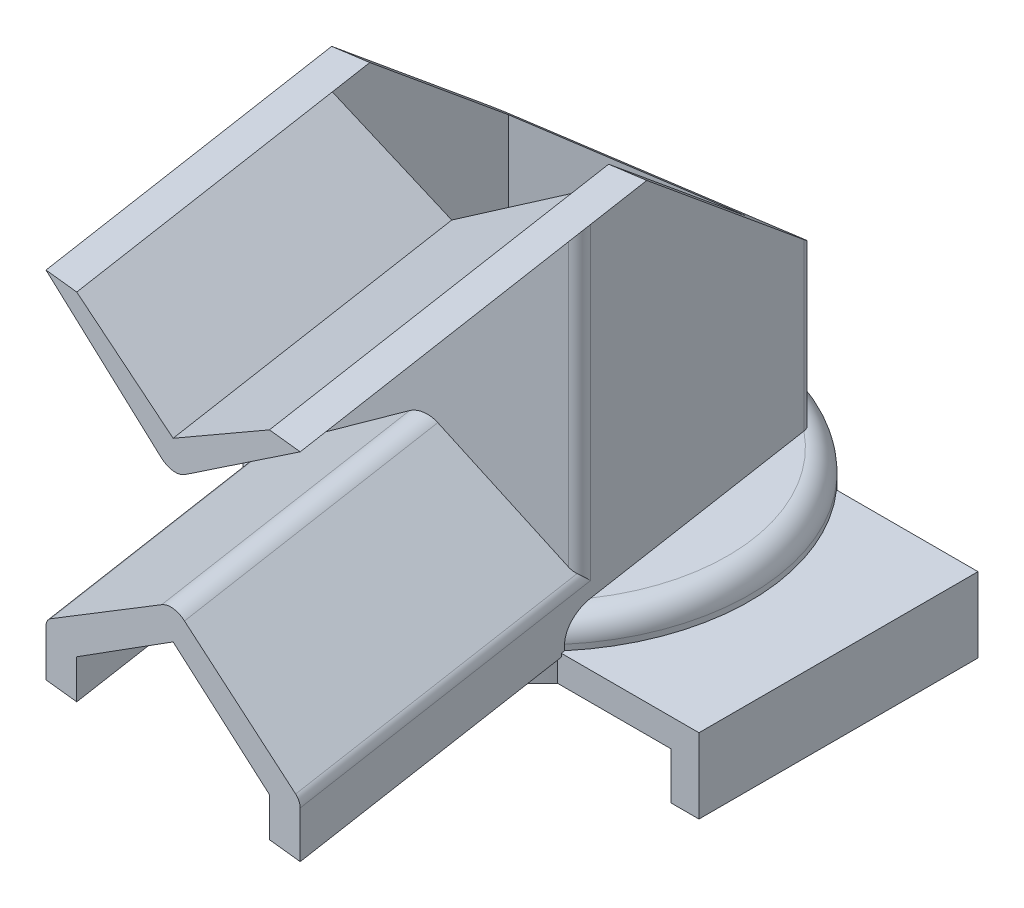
SolidWorks part; units mm, degrees
ref_plane "Front Plane" through (0, 0, 0) normal (0, 0, 1) x (1, 0, 0)
ref_plane "Top Plane" through (0, 0, 0) normal (0, 1, 0) x (1, 0, 0)
ref_plane "Right Plane" through (0, 0, 0) normal (1, 0, 0) x (0, 0, -1)
sketch "Sketch1" plane through (0, 0, 0) normal (0, 1, 0) x (1, 0, 0)
  circle A0 centre (0, 0) radius 6.1
  circle A1 centre (0, 0) radius 3.4
extrude "Boss-Extrude1" add sketch "Sketch1" along normal blind 3.7
sketch "Sketch2" plane through (0, 3.7, 0) normal (0, 1, 0) x (1, 0, 0)
  circle A0 centre (0, 0) radius 18.83
extrude "Boss-Extrude2" add sketch "Sketch2" along normal blind 5
sketch "Sketch5" plane through (0, 3.7, 0) normal (0, -1, 0) x (-1, 0, 0)
  line L0 (0, 0) -> (-21.3385, 0) construction
  line L2 (-10.7614, 12.5) -> (-26.7614, 12.5)
  line L3 (-10.7614, 12.5) -> (-10.7614, -12.5)
  line L4 (-10.7614, -12.5) -> (-26.7614, -12.5)
  line L5 (-26.7614, 12.5) -> (-26.7614, -12.5)
  line L6 (-10.7614, 12.5) -> (-26.7614, -12.5) construction
  line L7 (-10.7614, -12.5) -> (-26.7614, 12.5) construction
  point P3 (-18.7614, 0)
  dimension "D1" = 25
  dimension "D2" = 8
extrude "Boss-Extrude3" add sketch "Sketch5" against normal blind 2.5
sketch "Sketch6" plane through (0, 3.7, 0) normal (0, -1, 0) x (1, 0, 0)
  line L0 (14.0826, -12.5) -> (26.7614, -12.5) construction
  line L1 (26.7614, 12.5) -> (24.2614, 12.5)
  line L2 (26.7614, 12.5) -> (26.7614, -12.5)
  line L3 (26.7614, -12.5) -> (24.2614, -12.5)
  line L4 (24.2614, 12.5) -> (24.2614, -12.5)
  dimension "D1" = 2.5
extrude "Boss-Extrude4" add sketch "Sketch6" along normal blind 4.2
sketch "Sketch7" plane through (0, 8.7, 0) normal (0, 1, 0) x (1, 0, 0)
  line L0 (0, 0) -> (0, 21.2642) construction
  line L1 (14.1148, -10.4063) -> (-10.4063, -14.1148)
  line L2 (14.1148, -10.4063) -> (10.4063, 14.1148)
  line L3 (10.4063, 14.1148) -> (-14.1148, 10.4063)
  line L4 (-10.4063, -14.1148) -> (-14.1148, 10.4063)
  line L5 (14.1148, -10.4063) -> (-14.1148, 10.4063) construction
  line L6 (10.4063, 14.1148) -> (-10.4063, -14.1148) construction
  point P0 (0, 0)
  dimension "D1" = 24.8
  dimension "D2" = 24.8
  dimension "D3" = 8.6
  dimension "D5" = 12.4
  dimension "D6" = 12.4
extrude "Boss-Extrude5" add sketch "Sketch7" along normal blind 29
sketch "Sketch8" plane through (0, 37.7, 0) normal (0, 1, 0) x (1, 0, 0)
  line L0 (-10.4063, -14.1148) -> (14.1148, -10.4063) construction
  line L1 (10.6999, -7.8887) -> (-7.8887, -10.6999)
  line L2 (10.6999, -7.8887) -> (7.8887, 10.6999)
  line L3 (7.8887, 10.6999) -> (-10.6999, 7.8887)
  line L4 (-7.8887, -10.6999) -> (-10.6999, 7.8887)
  line L5 (10.6999, -7.8887) -> (-10.6999, 7.8887) construction
  line L6 (7.8887, 10.6999) -> (-7.8887, -10.6999) construction
  line L7 (10.4063, 14.1148) -> (-14.1148, 10.4063) construction
  line L8 (14.1148, -10.4063) -> (10.4063, 14.1148) construction
  line L9 (-14.1148, 10.4063) -> (-10.4063, -14.1148) construction
  point P0 (0, 0)
  dimension "D1" = 3
  dimension "D2" = 3
  dimension "D3" = 3
  dimension "D4" = 3
extrude "Cut-Extrude1" cut sketch "Sketch8" against normal blind 28
sketch "Sketch9" plane through (0, 3.7, 0) normal (0, -1, 0) x (1, 0, 0)
  circle A0 centre (0, 0) radius 3.4
extrude "Cut-Extrude2" cut sketch "Sketch9" against normal through all
sketch "Sketch10" plane through (1.8542, 0, 12.2606) normal (0.1495, 0, 0.9888) x (0.9888, 0, -0.1495)
  line L0 (12.4, 37.7) -> (12.4, 8.7) construction
  line L1 (-12.4, 37.7) -> (12.4, 37.7)
  line L2 (-12.4, 37.7) -> (-12.4, 28.7)
  line L3 (-12.4, 28.7) -> (12.4, 28.7)
  line L4 (12.4, 37.7) -> (12.4, 28.7)
  line L5 (-12.4, 37.7) -> (-12.4, 8.7) construction
  line L6 (-12.4, 18.9) -> (12.4, 18.9)
  line L7 (-12.4, 18.9) -> (-12.4, 5.9)
  line L8 (-12.4, 5.9) -> (12.4, 5.9)
  line L9 (12.4, 18.9) -> (12.4, 5.9)
  dimension "D1" = 9
  dimension "D2" = 13
  dimension "D3" = 9.8
extrude "Boss-Extrude6" add sketch "Sketch10" along normal blind 30
sketch "Sketch11" plane through (6.3403, 0, 41.9233) normal (0.1495, 0, 0.9888) x (0.9888, 0, -0.1495)
  line L0 (0, 0) -> (0, 42.4361) construction
  line L1 (0, 31.7) -> (12.8009, 31.7) construction
  line L2 (-12.4, 28.7) -> (12.4, 28.7) construction
  line L3 (0, 31.7) -> (-9.4, 37.7)
  line L4 (12.4, 37.7) -> (-12.4, 37.7) construction
  line L5 (-9.4, 37.7) -> (9.4, 37.7)
  line L6 (9.4, 37.7) -> (0, 31.7)
  dimension "D1" = 3
  dimension "D2" = 3
  dimension "D3" = 3
extrude "Cut-Extrude3" cut sketch "Sketch11" against normal through all
sketch "Sketch13" plane through (6.3403, 0, 41.9233) normal (0.1495, 0, 0.9888) x (0.9888, 0, -0.1495)
  line L0 (0, 28.7) -> (12.4, 28.7)
  line L1 (0, 28.7) -> (12.4, 37.7)
  line L2 (-12.4, 28.7) -> (12.4, 28.7) construction
  line L3 (12.4, 37.7) -> (12.4, 28.7)
extrude "Cut-Extrude4" cut sketch "Sketch13" against normal blind 30
sketch "Sketch15" plane through (6.3403, 0, 41.9233) normal (0.1495, 0, 0.9888) x (0.9888, 0, -0.1495)
  line L0 (-12.4, 37.7) -> (0, 28.7)
  line L1 (0, 28.7) -> (-12.4, 28.7)
  line L2 (-12.4, 28.7) -> (-12.4, 37.7)
extrude "Cut-Extrude5" cut sketch "Sketch15" against normal blind 30
sketch "Sketch16" plane through (6.3403, 0, 41.9233) normal (0.1495, 0, 0.9888) x (0.9888, 0, -0.1495)
  line L0 (12.4, 18.9) -> (12.4, 10.6)
  line L1 (12.4, 18.9) -> (-12.4, 18.9) construction
  line L2 (0, 18.9) -> (12.4, 18.9)
  line L3 (12.4, 10.6) -> (0, 18.9)
  line L5 (12.4, 5.9) -> (12.4, 18.9) construction
  dimension "D1" = 8.3
extrude "Cut-Extrude8" cut sketch "Sketch16" against normal blind 30
sketch "Sketch17" plane through (6.3403, 0, 41.9233) normal (0.1495, 0, 0.9888) x (0.9888, 0, -0.1495)
  line L1 (-12.4, 18.9) -> (-12.4, 5.9) construction
  line L2 (-12.4, 10.6) -> (-12.4, 18.9)
  line L3 (-12.4, 18.9) -> (0, 18.9)
  line L6 (-12.4, 10.6) -> (0, 18.9)
  dimension "D1" = 8.3
extrude "Cut-Extrude9" cut sketch "Sketch17" against normal blind 30
sketch "Sketch18" plane through (6.3403, 0, 41.9233) normal (0.1495, 0, 0.9888) x (0.9888, 0, -0.1495)
  line L0 (0, 22.5727) -> (0, -2.6452) construction
  line L1 (0, 15.9) -> (9.4, 9.4)
  line L2 (9.4, 9.4) -> (9.4, 5.9)
  line L3 (-12.4, 5.9) -> (12.055, 5.9) construction
  line L4 (9.4, 5.9) -> (-9.4, 5.9)
  line L5 (-9.4, 5.9) -> (-9.4, 9.4)
  line L6 (-9.4, 9.4) -> (0, 15.9)
  line L7 (-12.4, 10.6) -> (-12.4, 5.9) construction
  line L8 (12.4, 5.9) -> (12.4, 10.6) construction
  dimension "D1" = 3
  dimension "D2" = 3
  dimension "D3" = 3
  dimension "D4" = 3.5
  dimension "D5" = 3.5
extrude "Cut-Extrude10" cut sketch "Sketch18" against normal blind 25
sketch "Sketch19" plane through (12.2606, 0, -1.8542) normal (0.9888, 0, -0.1495) x (-0.1495, 0, -0.9888)
  line L0 (12.4, 22.7) -> (-5.4, 37.7)
  line L1 (12.4, 37.7) -> (12.4, 8.7) construction
  line L2 (-12.4, 37.7) -> (12.4, 37.7) construction
  line L3 (-5.4, 37.7) -> (12.4, 37.7)
  line L4 (12.4, 37.7) -> (12.4, 22.7)
  dimension "D1" = 14
  dimension "D2" = 7
extrude "Cut-Extrude11" cut sketch "Sketch19" against normal through all
fillet "Fillet3" radius 2 1 edges at (-2.8158, 8.7, -18.6183)
sketch "Sketch20" plane through (0, 0, 0) normal (0, -1, 0) x (1, 0, 0)
  circle A0 centre (0, 0) radius 4.25
extrude "Cut-Extrude12" cut sketch "Sketch20" against normal blind 3
sketch "Sketch21" plane through (0, 37.7, 0) normal (0, 1, 0) x (1, 0, 0)
  line L0 (-5.9203, -43.7775) -> (-6.8923, -37.3506)
  line L2 (-10.4063, -14.1148) -> (-5.9203, -43.7775) construction
  line L3 (-6.8923, -37.3506) -> (18.6009, -40.069)
  line L4 (18.6009, -40.069) -> (-5.9203, -43.7775)
  dimension "D1" = 30.5
extrude "Cut-Extrude13" cut sketch "Sketch21" against normal through all
fillet "Fillet4" radius 2 2 edges at (3.8543, 28.7, 25.4852) (3.8543, 18.9, 25.4852)
fillet "Fillet5" radius 1 4 edges at (10.4063, 15.6356, -14.1148) (14.1148, 24.15, 10.4063) (-10.4063, 24.15, 14.1148) (-14.1148, 15.6356, -10.4063)
fillet "Fillet6" radius 1 2 edges at (16.2831, 10.6, 24.7433) (-8.7241, 10.6, 25.2383)
